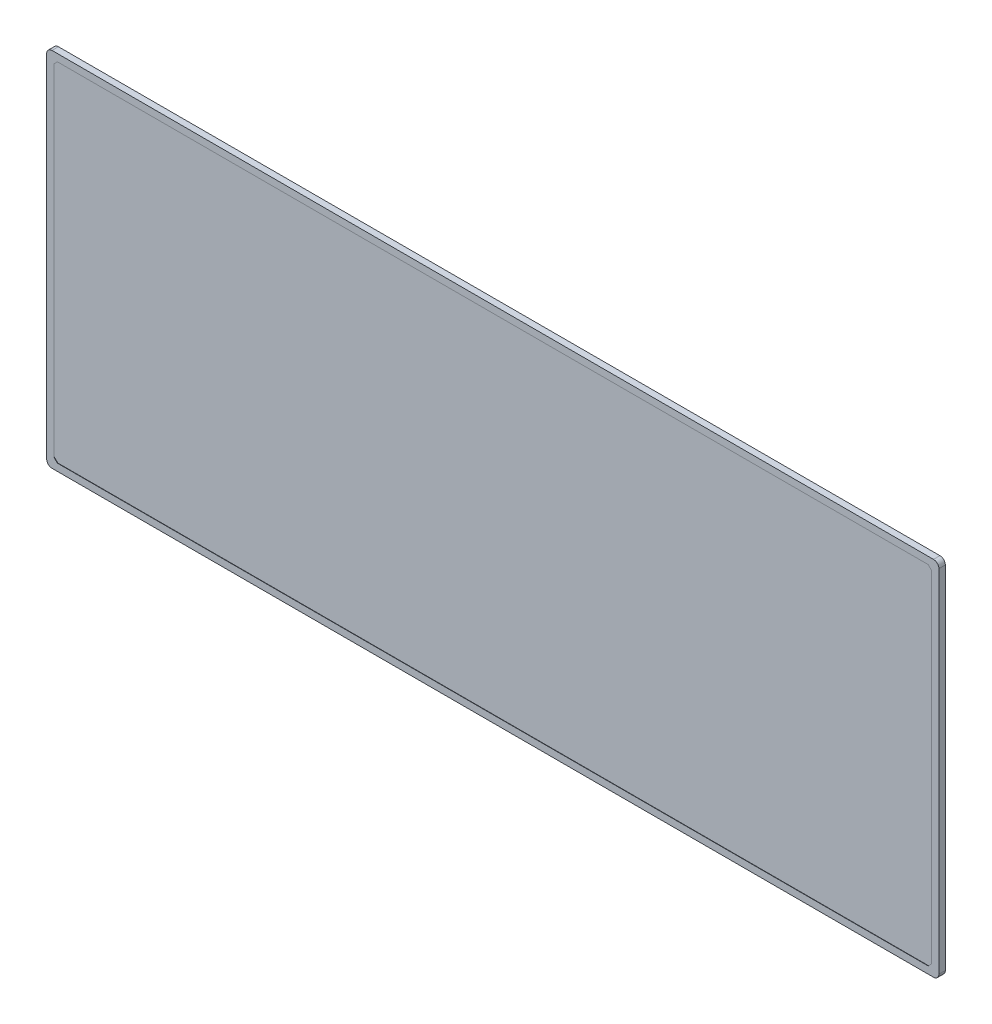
SolidWorks part; units mm, degrees
ref_plane "Front Plane" through (0, 0, 0) normal (0, 0, 1) x (1, 0, 0)
ref_plane "Top Plane" through (0, 0, 0) normal (0, 1, 0) x (1, 0, 0)
ref_plane "Right Plane" through (0, 0, 0) normal (1, 0, 0) x (0, 0, -1)
sketch "Sketch2" plane through (0, 0, 0) normal (0, 0, 1) x (1, 0, 0)
  line L1 (-1227.5, -486) -> (1227.5, -486)
  line L2 (-1227.5, -486) -> (-1227.5, 486)
  line L3 (-1227.5, 486) -> (1227.5, 486)
  line L4 (1227.5, -486) -> (1227.5, 486)
  line L5 (-1227.5, -486) -> (1227.5, 486) construction
  line L6 (-1227.5, 486) -> (1227.5, -486) construction
  point P0 (0, 0)
  dimension "D1" = 2455
  dimension "D2" = 972
extrude "Boss-Extrude1" add sketch "Sketch2" along normal blind 17
sketch "Sketch3" plane through (0, 0, 0) normal (0, 0, -1) x (-1, 0, 0)
  line L0 (1247.5, 506) -> (-1247.5, 506)
  line L1 (-1247.5, 506) -> (-1247.5, -506)
  line L2 (-1247.5, -506) -> (1247.5, -506)
  line L3 (1247.5, -506) -> (1247.5, 506)
  line L4 (-1227.5, 486) -> (-1227.5, -486)
  line L5 (1227.5, 486) -> (-1227.5, 486)
  line L6 (1227.5, -486) -> (1227.5, 486)
  line L7 (-1227.5, -486) -> (1227.5, -486)
  line L8 (-1227.5, 486) -> (-1227.5, -486)
  line L9 (1227.5, 486) -> (-1227.5, 486)
  line L10 (1227.5, -486) -> (1227.5, 486)
  line L11 (-1227.5, -486) -> (1227.5, -486)
  dimension "D1" = 0
  dimension "D2" = 20
extrude "Boss-Extrude2" add sketch "Sketch3" against normal blind 18
fillet "Fillet1" radius 15 4 edges at (-1247.5, 506, 9) (-1247.5, -506, 9) (1247.5, -506, 9) (1247.5, 506, 9)
chamfer "Chamfer1" distance 10 angle 45 4 edges at (1227.5, 486, 17.5) (-1227.5, 486, 17.5) (-1227.5, -486, 17.5) (1227.5, -486, 17.5)
